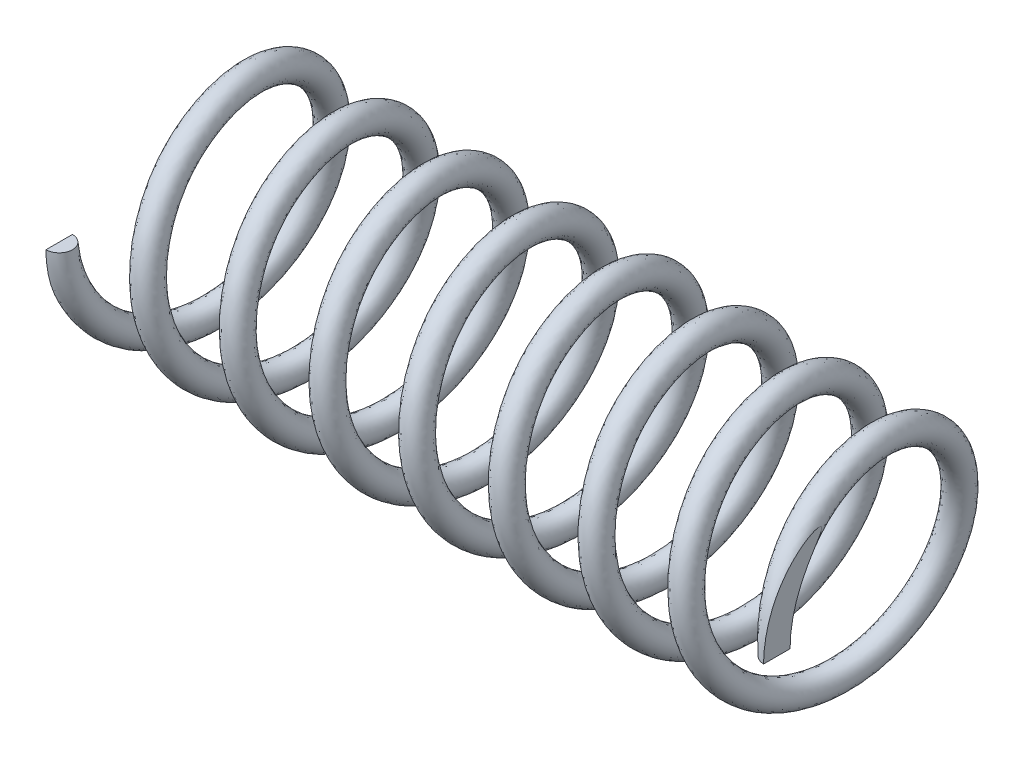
SolidWorks part; units mm, degrees
ref_plane "Front Plane" through (0, 0, 0) normal (0, 0, 1) x (1, 0, 0)
ref_plane "Top Plane" through (0, 0, 0) normal (0, 1, 0) x (1, 0, 0)
ref_plane "Right Plane" through (0, 0, 0) normal (1, 0, 0) x (0, 0, -1)
sketch "Sketch1" plane through (0, 0, 0) normal (0, 1, 0) x (1, 0, 0)
  line L0 (0, 0) -> (48.26, 0)
  line L1 (48.26, 8.2105) -> (48.26, -0.0763) construction
sketch "Sketch2" plane through (0, 0, 0) normal (0, 1, 0) x (1, 0, 0)
  circle A0 centre (0, -7.62) radius 0.889
  dimension "D1" = 1.778
  dimension "D2" = 7.62
sweep "Sweep1" add profiles "Sketch2" path "Sketch1" parameters "D1"=2880
sketch "Sketch3" plane through (0, 0, 0) normal (0, 0, 1) x (1, 0, 0)
  line L1 (0, 10.16) -> (48.26, 10.16)
  line L2 (0, 10.16) -> (0, -10.16)
  line L3 (0, -10.16) -> (48.26, -10.16)
  line L4 (48.26, 10.16) -> (48.26, -10.16)
  dimension "D1" = 20.32
  dimension "D2" = 48.26
extrude "Cut-Extrude1" cut sketch "Sketch3" against normal through all and the other way through all flip side to cut
